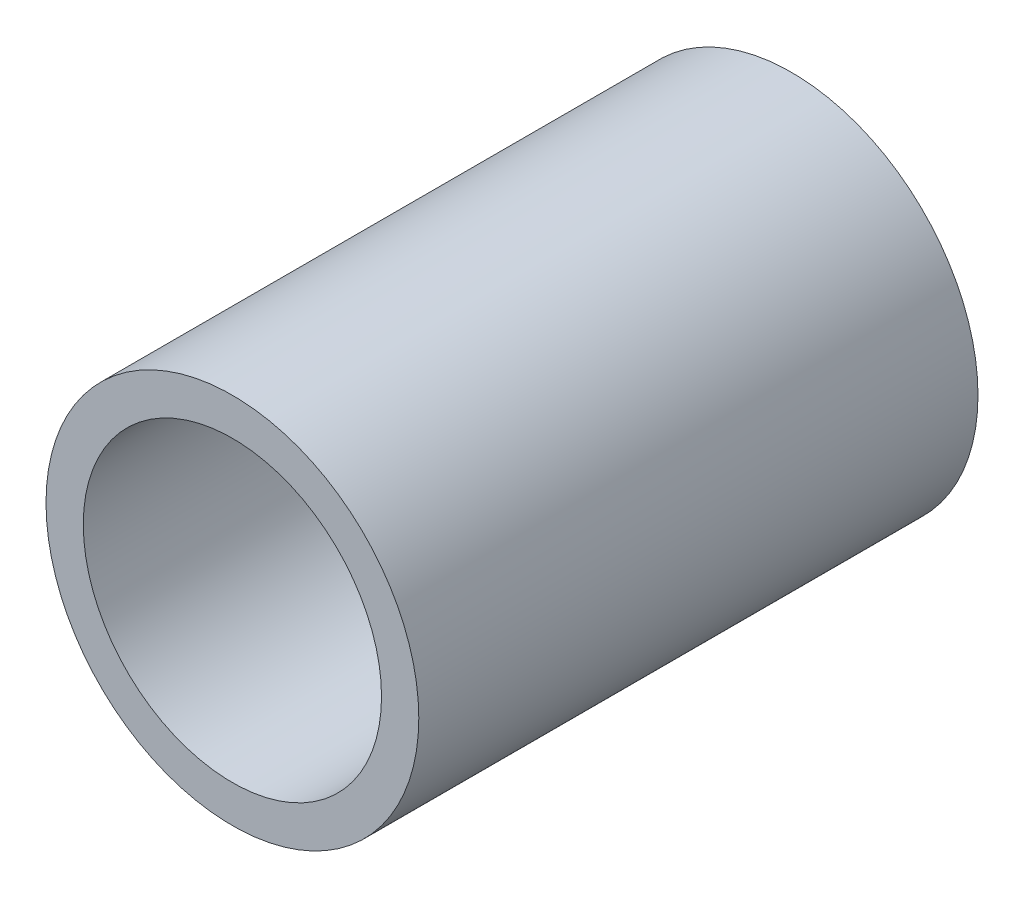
SolidWorks part; units mm, degrees
ref_plane "Frontal" through (0, 0, 0) normal (0, 0, 1) x (1, 0, 0)
ref_plane "Horizontal" through (0, 0, 0) normal (0, 1, 0) x (1, 0, 0)
ref_plane "Profil" through (0, 0, 0) normal (1, 0, 0) x (0, 0, -1)
sketch "Esquisse1" plane through (0, 0, 0) normal (0, 0, 1) x (1, 0, 0)
  circle A0 centre (0, 0) radius 16
  circle A1 centre (0, 0) radius 20
  dimension "D1" = 32
  dimension "D2" = 40
extrude "Base-Extrusion" add sketch "Esquisse1" along normal blind 60
